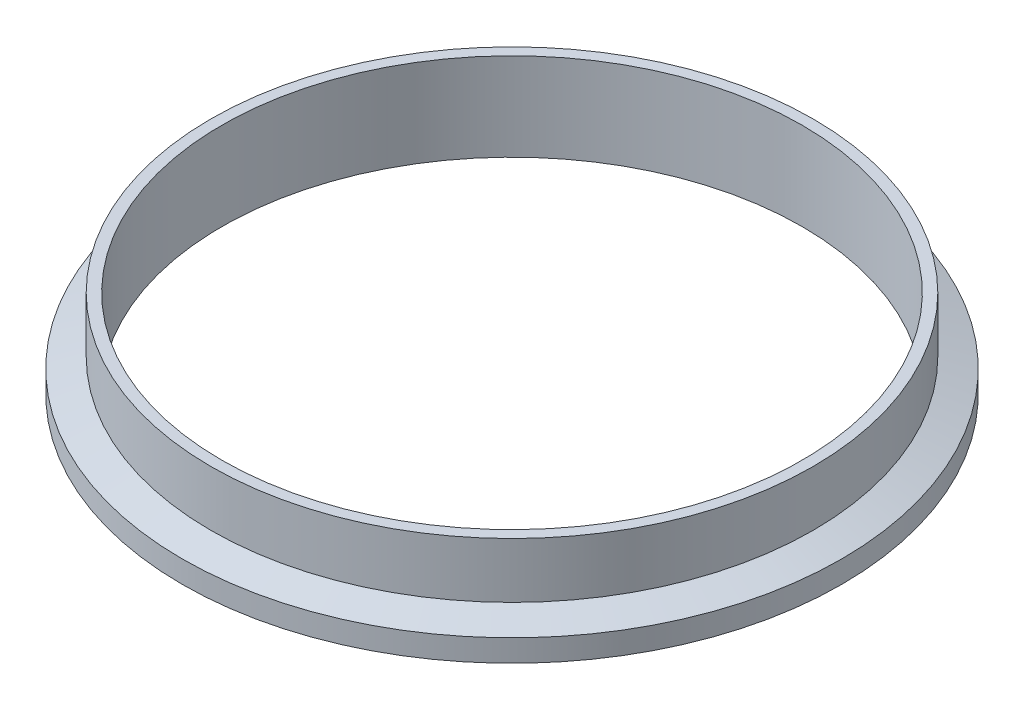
SolidWorks part; units mm, degrees
ref_plane "Front Plane" through (0, 0, 0) normal (0, 0, 1) x (1, 0, 0)
ref_plane "Top Plane" through (0, 0, 0) normal (0, 1, 0) x (1, 0, 0)
ref_plane "Right Plane" through (0, 0, 0) normal (1, 0, 0) x (0, 0, -1)
sketch "Sketch1" plane through (0, 0, 0) normal (0, 0, 1) x (1, 0, 0)
  line L0 (0, 0) -> (0, 22.225) construction
  line L1 (0, 22.225) -> (-76.2, 22.225)
  line L2 (-76.2, 22.225) -> (-76.2, 8.2228)
  line L3 (-76.2, 8.2228) -> (-83.439, 5.588)
  line L4 (-83.439, 5.588) -> (-83.439, 0)
  line L5 (-83.439, 0) -> (-79.9992, 0)
  line L6 (-76.3632, 0) -> (0, 0)
  line L7 (0, 0) -> (0, 22.225)
  line L8 (0, 22.225) -> (-73.4314, 22.225)
  line L9 (-73.4314, 22.225) -> (-73.4314, 0)
  line L10 (-73.4314, 0) -> (0, 0)
  line L11 (0, 0) -> (-0.1846, 0.0129)
  arc A0 (-79.2767, 0.4745) -> (-77.0857, 0.4745) centre (-78.1812, 0) cw
  arc A1 (-76.3632, 0) -> (-77.0857, 0.4745) centre (-76.3632, 0.7874) cw
  arc A2 (-79.2767, 0.4745) -> (-79.9992, 0) centre (-79.9992, 0.7874) cw
  point P12 (-76.9874, 0)
  dimension "D6" = 1.1938
  dimension "D7" = 0.7874
  dimension "3.00" = 76.2
  dimension "D2" = 5.588
  dimension "D3" = 83.439
  dimension "D4" = 70
  dimension "D5" = 78.1812
  dimension "D8" = 2.7686
  dimension "D9" = 22.225
revolve "Revolve2" add sketch "Sketch1" angle 360 about L0
